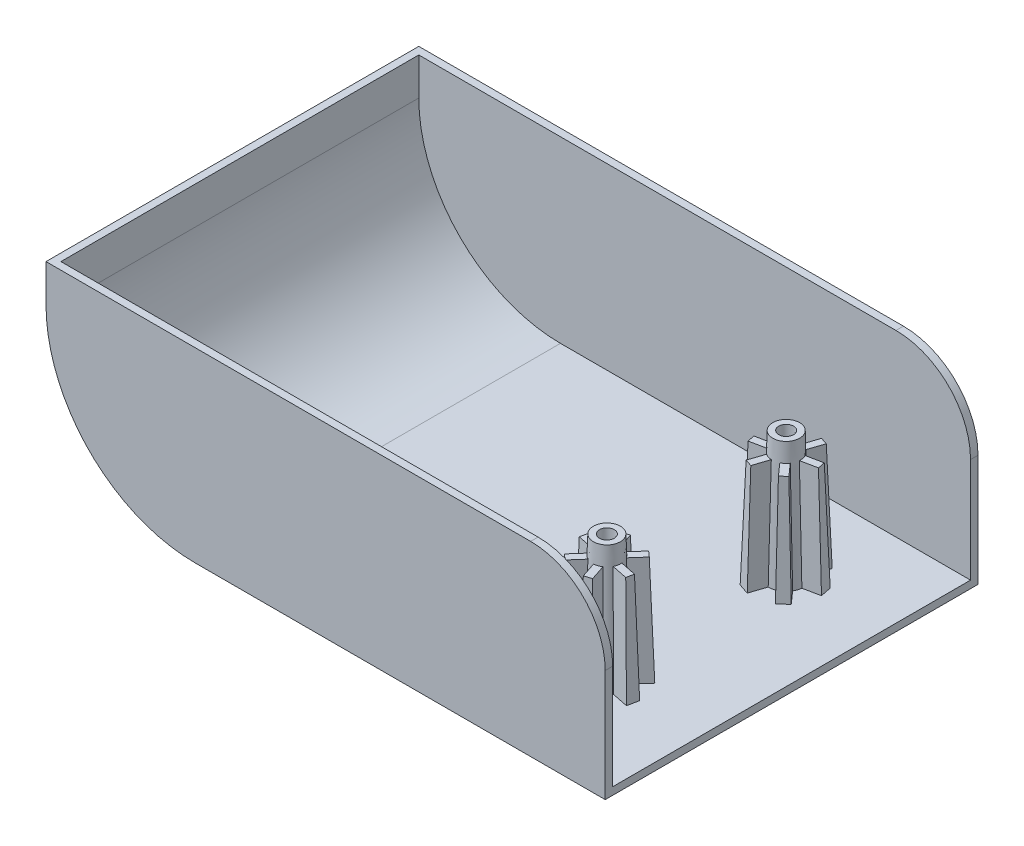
SolidWorks part; units mm, degrees
ref_plane "Front Plane" through (0, 0, 0) normal (0, 0, 1) x (1, 0, 0)
ref_plane "Top Plane" through (0, 0, 0) normal (0, 1, 0) x (1, 0, 0)
ref_plane "Right Plane" through (0, 0, 0) normal (1, 0, 0) x (0, 0, -1)
sketch "Sketch1" plane through (0, 0, 0) normal (0, 0, 1) x (1, 0, 0)
  line L0 (0, 0) -> (0, 57.2412) construction
  line L5 (-75, 20) -> (-75, 25)
  line L6 (0, 25) -> (-75, 25)
  line L7 (0, 0) -> (0, 25)
  line L8 (0, 0) -> (-55, 0)
  arc A1 (-55, 0) -> (-75, 20) centre (-55, 20) cw
extrude "Extrude1" add sketch "Sketch1" along normal mid plane 50
fillet "Fillet1" radius 10 1 edges at (0, 25, 0)
shell "Shell1" thickness 1
sketch3d "3DSketch1"
  point P0 (-12.7517, 1, 12.0249)
other "Mounting Boss1" parameters "BossDiam"=4.8, "BossHeight"=17, "FinHeight"=14.5, "FinLength"=4, "FinWidth"=1.5, "InsDiam"=2, "InsHeight"=5, "BossDraft"=2, "FinDraft"=1, "InsDraft"=1, "D11"=0, "D12"=0, "D13"=0, "D14"=0, "D15"=0, "D16"=0, "D17"=0, "D18"=0, "Clearance"=0, "ChamferDist"=0, "ChamferAngle"=0
mirror "Mirror1" about plane through (0, 0, 0) normal (0, 0, 1) of "Mounting Boss1"
